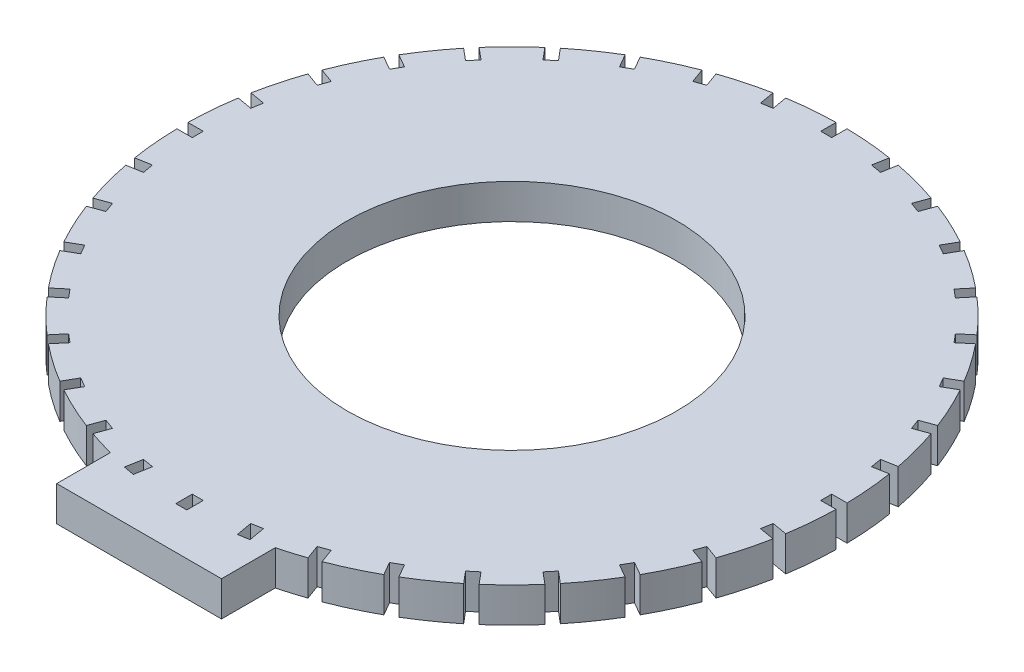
SolidWorks part; units mm, degrees
ref_plane "Front Plane" through (0, 0, 0) normal (0, 0, 1) x (1, 0, 0)
ref_plane "Top Plane" through (0, 0, 0) normal (0, 1, 0) x (1, 0, 0)
ref_plane "Right Plane" through (0, 0, 0) normal (1, 0, 0) x (0, 0, -1)
sketch "Sketch1" plane through (0, 0, 0) normal (0, 1, 0) x (1, 0, 0)
  line L0 (-7.5, -33.94) -> (-7.5, -29.0474)
  line L1 (7.5, -33.94) -> (7.5, -29.0474)
  line L2 (-7.5, -33.94) -> (7.5, -33.94)
  line L3 (0, -33.94) -> (0, -30) construction
  circle A0 centre (0, 0) radius 15
  circle A1 centre (0, 0) radius 30
  dimension "D3" = 15
  dimension "D2" = 15
  dimension "D4" = 33.94
  dimension "D1" = 15
extrude "Boss-Extrude1" add sketch "Sketch1" along normal blind 3.175 contours A1 A0 | L2 L3 A1 L0 | L3 L2 L1 A1
sketch "Sketch2" plane through (0, 3.175, 0) normal (0, 1, 0) x (1, 0, 0)
  line L0 (4.474, 28.2523) -> (4.7345, 29.7295)
  line L1 (-0.5, 28.6) -> (0.5, 28.6)
  line L2 (-0.5, 28.6) -> (-0.5, 30.1)
  line L3 (-0.5, 30.1) -> (0.5, 30.1)
  line L4 (0.5, 28.6) -> (0.5, 30.1)
  line L5 (-0.5, 28.6) -> (0.5, 30.1) construction
  line L6 (-0.5, 30.1) -> (0.5, 28.6) construction
  line L7 (4.474, 28.2523) -> (5.4588, 28.0787)
  line L8 (5.4588, 28.0787) -> (5.7193, 29.5559)
  line L9 (4.7345, 29.7295) -> (5.7193, 29.5559)
  line L10 (4.474, 28.2523) -> (5.7193, 29.5559) construction
  line L11 (4.7345, 29.7295) -> (5.4588, 28.0787) construction
  line L12 (9.3121, 27.0462) -> (9.8251, 28.4557)
  line L13 (9.3121, 27.0462) -> (10.2518, 26.7042)
  line L14 (10.2518, 26.7042) -> (10.7648, 28.1137)
  line L15 (9.8251, 28.4557) -> (10.7648, 28.1137)
  line L16 (9.3121, 27.0462) -> (10.7648, 28.1137) construction
  line L17 (9.8251, 28.4557) -> (10.2518, 26.7042) construction
  line L18 (13.8672, 25.0183) -> (14.6172, 26.3173)
  line L19 (13.8672, 25.0183) -> (14.7333, 24.5183)
  line L20 (14.7333, 24.5183) -> (15.4833, 25.8173)
  line L21 (14.6172, 26.3173) -> (15.4833, 25.8173)
  line L22 (13.8672, 25.0183) -> (15.4833, 25.8173) construction
  line L23 (14.6172, 26.3173) -> (14.7333, 24.5183) construction
  line L24 (18.001, 22.2302) -> (18.9652, 23.3792)
  line L25 (18.001, 22.2302) -> (18.7671, 21.5874)
  line L26 (18.7671, 21.5874) -> (19.7312, 22.7364)
  line L27 (18.9652, 23.3792) -> (19.7312, 22.7364)
  line L28 (18.001, 22.2302) -> (19.7312, 22.7364) construction
  line L29 (18.9652, 23.3792) -> (18.7671, 21.5874) construction
  line L30 (21.5878, 18.7666) -> (22.7369, 19.7308)
  line L31 (21.5878, 18.7666) -> (22.2306, 18.0005)
  line L32 (22.2306, 18.0005) -> (23.3797, 18.9647)
  line L33 (22.7369, 19.7308) -> (23.3797, 18.9647)
  line L34 (21.5878, 18.7666) -> (23.3797, 18.9647) construction
  line L35 (22.7369, 19.7308) -> (22.2306, 18.0005) construction
  line L36 (24.5187, 14.7328) -> (25.8178, 15.4828)
  line L37 (24.5187, 14.7328) -> (25.0187, 13.8667)
  line L38 (25.0187, 13.8667) -> (26.3178, 14.6167)
  line L39 (25.8178, 15.4828) -> (26.3178, 14.6167)
  line L40 (24.5187, 14.7328) -> (26.3178, 14.6167) construction
  line L41 (25.8178, 15.4828) -> (25.0187, 13.8667) construction
  line L42 (26.7046, 10.2513) -> (28.1142, 10.7643)
  line L43 (26.7046, 10.2513) -> (27.0467, 9.3116)
  line L44 (27.0467, 9.3116) -> (28.4562, 9.8246)
  line L45 (28.1142, 10.7643) -> (28.4562, 9.8246)
  line L46 (26.7046, 10.2513) -> (28.4562, 9.8246) construction
  line L47 (28.1142, 10.7643) -> (27.0467, 9.3116) construction
  line L48 (28.0791, 5.4583) -> (29.5564, 5.7188)
  line L49 (28.0791, 5.4583) -> (28.2528, 4.4735)
  line L50 (28.2528, 4.4735) -> (29.73, 4.734)
  line L51 (29.5564, 5.7188) -> (29.73, 4.734)
  line L52 (28.0791, 5.4583) -> (29.73, 4.734) construction
  line L53 (29.5564, 5.7188) -> (28.2528, 4.4735) construction
  line L54 (28.6005, 0.4995) -> (30.1005, 0.4995)
  line L55 (28.6005, 0.4995) -> (28.6005, -0.5005)
  line L56 (28.6005, -0.5005) -> (30.1005, -0.5005)
  line L57 (30.1005, 0.4995) -> (30.1005, -0.5005)
  line L58 (28.6005, 0.4995) -> (30.1005, -0.5005) construction
  line L59 (30.1005, 0.4995) -> (28.6005, -0.5005) construction
  line L60 (28.2528, -4.4745) -> (29.73, -4.735)
  line L61 (28.2528, -4.4745) -> (28.0791, -5.4593)
  line L62 (28.0791, -5.4593) -> (29.5564, -5.7198)
  line L63 (29.73, -4.735) -> (29.5564, -5.7198)
  line L64 (28.2528, -4.4745) -> (29.5564, -5.7198) construction
  line L65 (29.73, -4.735) -> (28.0791, -5.4593) construction
  line L66 (27.0467, -9.3126) -> (28.4562, -9.8256)
  line L67 (27.0467, -9.3126) -> (26.7046, -10.2523)
  line L68 (26.7046, -10.2523) -> (28.1142, -10.7653)
  line L69 (28.4562, -9.8256) -> (28.1142, -10.7653)
  line L70 (27.0467, -9.3126) -> (28.1142, -10.7653) construction
  line L71 (28.4562, -9.8256) -> (26.7046, -10.2523) construction
  line L72 (25.0187, -13.8677) -> (26.3178, -14.6177)
  line L73 (25.0187, -13.8677) -> (24.5187, -14.7337)
  line L74 (24.5187, -14.7337) -> (25.8178, -15.4837)
  line L75 (26.3178, -14.6177) -> (25.8178, -15.4837)
  line L76 (25.0187, -13.8677) -> (25.8178, -15.4837) construction
  line L77 (26.3178, -14.6177) -> (24.5187, -14.7337) construction
  line L78 (22.2306, -18.0015) -> (23.3797, -18.9657)
  line L79 (22.2306, -18.0015) -> (21.5878, -18.7675)
  line L80 (21.5878, -18.7675) -> (22.7369, -19.7317)
  line L81 (23.3797, -18.9657) -> (22.7369, -19.7317)
  line L82 (22.2306, -18.0015) -> (22.7369, -19.7317) construction
  line L83 (23.3797, -18.9657) -> (21.5878, -18.7675) construction
  line L84 (18.7671, -21.5883) -> (19.7312, -22.7374)
  line L85 (18.7671, -21.5883) -> (18.001, -22.2311)
  line L86 (18.001, -22.2311) -> (18.9652, -23.3802)
  line L87 (19.7312, -22.7374) -> (18.9652, -23.3802)
  line L88 (18.7671, -21.5883) -> (18.9652, -23.3802) construction
  line L89 (19.7312, -22.7374) -> (18.001, -22.2311) construction
  line L90 (14.7333, -24.5192) -> (15.4833, -25.8183)
  line L91 (14.7333, -24.5192) -> (13.8672, -25.0192)
  line L92 (13.8672, -25.0192) -> (14.6172, -26.3183)
  line L93 (15.4833, -25.8183) -> (14.6172, -26.3183)
  line L94 (14.7333, -24.5192) -> (14.6172, -26.3183) construction
  line L95 (15.4833, -25.8183) -> (13.8672, -25.0192) construction
  line L96 (10.2518, -26.7051) -> (10.7648, -28.1147)
  line L97 (10.2518, -26.7051) -> (9.3121, -27.0471)
  line L98 (9.3121, -27.0471) -> (9.8251, -28.4567)
  line L99 (10.7648, -28.1147) -> (9.8251, -28.4567)
  line L100 (10.2518, -26.7051) -> (9.8251, -28.4567) construction
  line L101 (10.7648, -28.1147) -> (9.3121, -27.0471) construction
  line L102 (5.4588, -28.0796) -> (5.7193, -29.5568)
  line L103 (5.4588, -28.0796) -> (4.474, -28.2533)
  line L104 (4.474, -28.2533) -> (4.7345, -29.7305)
  line L105 (5.7193, -29.5568) -> (4.7345, -29.7305)
  line L106 (5.4588, -28.0796) -> (4.7345, -29.7305) construction
  line L107 (5.7193, -29.5568) -> (4.474, -28.2533) construction
  line L108 (0.5, -28.601) -> (0.5, -30.101)
  line L109 (0.5, -28.601) -> (-0.5, -28.601)
  line L110 (-0.5, -28.601) -> (-0.5, -30.101)
  line L111 (0.5, -30.101) -> (-0.5, -30.101)
  line L112 (0.5, -28.601) -> (-0.5, -30.101) construction
  line L113 (0.5, -30.101) -> (-0.5, -28.601) construction
  line L114 (-4.474, -28.2533) -> (-4.7345, -29.7305)
  line L115 (-4.474, -28.2533) -> (-5.4588, -28.0796)
  line L116 (-5.4588, -28.0796) -> (-5.7193, -29.5568)
  line L117 (-4.7345, -29.7305) -> (-5.7193, -29.5568)
  line L118 (-4.474, -28.2533) -> (-5.7193, -29.5568) construction
  line L119 (-4.7345, -29.7305) -> (-5.4588, -28.0796) construction
  line L120 (-9.3121, -27.0471) -> (-9.8251, -28.4567)
  line L121 (-9.3121, -27.0471) -> (-10.2518, -26.7051)
  line L122 (-10.2518, -26.7051) -> (-10.7648, -28.1147)
  line L123 (-9.8251, -28.4567) -> (-10.7648, -28.1147)
  line L124 (-9.3121, -27.0471) -> (-10.7648, -28.1147) construction
  line L125 (-9.8251, -28.4567) -> (-10.2518, -26.7051) construction
  line L126 (-13.8672, -25.0192) -> (-14.6172, -26.3183)
  line L127 (-13.8672, -25.0192) -> (-14.7333, -24.5192)
  line L128 (-14.7333, -24.5192) -> (-15.4833, -25.8183)
  line L129 (-14.6172, -26.3183) -> (-15.4833, -25.8183)
  line L130 (-13.8672, -25.0192) -> (-15.4833, -25.8183) construction
  line L131 (-14.6172, -26.3183) -> (-14.7333, -24.5192) construction
  line L132 (-18.001, -22.2311) -> (-18.9652, -23.3802)
  line L133 (-18.001, -22.2311) -> (-18.7671, -21.5883)
  line L134 (-18.7671, -21.5883) -> (-19.7312, -22.7374)
  line L135 (-18.9652, -23.3802) -> (-19.7312, -22.7374)
  line L136 (-18.001, -22.2311) -> (-19.7312, -22.7374) construction
  line L137 (-18.9652, -23.3802) -> (-18.7671, -21.5883) construction
  line L138 (-21.5878, -18.7675) -> (-22.7369, -19.7317)
  line L139 (-21.5878, -18.7675) -> (-22.2306, -18.0015)
  line L140 (-22.2306, -18.0015) -> (-23.3797, -18.9657)
  line L141 (-22.7369, -19.7317) -> (-23.3797, -18.9657)
  line L142 (-21.5878, -18.7675) -> (-23.3797, -18.9657) construction
  line L143 (-22.7369, -19.7317) -> (-22.2306, -18.0015) construction
  line L144 (-24.5187, -14.7337) -> (-25.8178, -15.4837)
  line L145 (-24.5187, -14.7337) -> (-25.0187, -13.8677)
  line L146 (-25.0187, -13.8677) -> (-26.3178, -14.6177)
  line L147 (-25.8178, -15.4837) -> (-26.3178, -14.6177)
  line L148 (-24.5187, -14.7337) -> (-26.3178, -14.6177) construction
  line L149 (-25.8178, -15.4837) -> (-25.0187, -13.8677) construction
  line L150 (-26.7046, -10.2523) -> (-28.1142, -10.7653)
  line L151 (-26.7046, -10.2523) -> (-27.0467, -9.3126)
  line L152 (-27.0467, -9.3126) -> (-28.4562, -9.8256)
  line L153 (-28.1142, -10.7653) -> (-28.4562, -9.8256)
  line L154 (-26.7046, -10.2523) -> (-28.4562, -9.8256) construction
  line L155 (-28.1142, -10.7653) -> (-27.0467, -9.3126) construction
  line L156 (-28.0791, -5.4593) -> (-29.5564, -5.7198)
  line L157 (-28.0791, -5.4593) -> (-28.2528, -4.4745)
  line L158 (-28.2528, -4.4745) -> (-29.73, -4.735)
  line L159 (-29.5564, -5.7198) -> (-29.73, -4.735)
  line L160 (-28.0791, -5.4593) -> (-29.73, -4.735) construction
  line L161 (-29.5564, -5.7198) -> (-28.2528, -4.4745) construction
  line L162 (-28.6005, -0.5005) -> (-30.1005, -0.5005)
  line L163 (-28.6005, -0.5005) -> (-28.6005, 0.4995)
  line L164 (-28.6005, 0.4995) -> (-30.1005, 0.4995)
  line L165 (-30.1005, -0.5005) -> (-30.1005, 0.4995)
  line L166 (-28.6005, -0.5005) -> (-30.1005, 0.4995) construction
  line L167 (-30.1005, -0.5005) -> (-28.6005, 0.4995) construction
  line L168 (-28.2528, 4.4735) -> (-29.73, 4.734)
  line L169 (-28.2528, 4.4735) -> (-28.0791, 5.4583)
  line L170 (-28.0791, 5.4583) -> (-29.5564, 5.7188)
  line L171 (-29.73, 4.734) -> (-29.5564, 5.7188)
  line L172 (-28.2528, 4.4735) -> (-29.5564, 5.7188) construction
  line L173 (-29.73, 4.734) -> (-28.0791, 5.4583) construction
  line L174 (-27.0467, 9.3116) -> (-28.4562, 9.8246)
  line L175 (-27.0467, 9.3116) -> (-26.7046, 10.2513)
  line L176 (-26.7046, 10.2513) -> (-28.1142, 10.7643)
  line L177 (-28.4562, 9.8246) -> (-28.1142, 10.7643)
  line L178 (-27.0467, 9.3116) -> (-28.1142, 10.7643) construction
  line L179 (-28.4562, 9.8246) -> (-26.7046, 10.2513) construction
  line L180 (-25.0187, 13.8667) -> (-26.3178, 14.6167)
  line L181 (-25.0187, 13.8667) -> (-24.5187, 14.7328)
  line L182 (-24.5187, 14.7328) -> (-25.8178, 15.4828)
  line L183 (-26.3178, 14.6167) -> (-25.8178, 15.4828)
  line L184 (-25.0187, 13.8667) -> (-25.8178, 15.4828) construction
  line L185 (-26.3178, 14.6167) -> (-24.5187, 14.7328) construction
  line L186 (-22.2306, 18.0005) -> (-23.3797, 18.9647)
  line L187 (-22.2306, 18.0005) -> (-21.5878, 18.7666)
  line L188 (-21.5878, 18.7666) -> (-22.7369, 19.7308)
  line L189 (-23.3797, 18.9647) -> (-22.7369, 19.7308)
  line L190 (-22.2306, 18.0005) -> (-22.7369, 19.7308) construction
  line L191 (-23.3797, 18.9647) -> (-21.5878, 18.7666) construction
  line L192 (-18.7671, 21.5874) -> (-19.7312, 22.7364)
  line L193 (-18.7671, 21.5874) -> (-18.001, 22.2302)
  line L194 (-18.001, 22.2302) -> (-18.9652, 23.3792)
  line L195 (-19.7312, 22.7364) -> (-18.9652, 23.3792)
  line L196 (-18.7671, 21.5874) -> (-18.9652, 23.3792) construction
  line L197 (-19.7312, 22.7364) -> (-18.001, 22.2302) construction
  line L198 (-14.7333, 24.5183) -> (-15.4833, 25.8173)
  line L199 (-14.7333, 24.5183) -> (-13.8672, 25.0183)
  line L200 (-13.8672, 25.0183) -> (-14.6172, 26.3173)
  line L201 (-15.4833, 25.8173) -> (-14.6172, 26.3173)
  line L202 (-14.7333, 24.5183) -> (-14.6172, 26.3173) construction
  line L203 (-15.4833, 25.8173) -> (-13.8672, 25.0183) construction
  line L204 (-10.2518, 26.7042) -> (-10.7648, 28.1137)
  line L205 (-10.2518, 26.7042) -> (-9.3121, 27.0462)
  line L206 (-9.3121, 27.0462) -> (-9.8251, 28.4557)
  line L207 (-10.7648, 28.1137) -> (-9.8251, 28.4557)
  line L208 (-10.2518, 26.7042) -> (-9.8251, 28.4557) construction
  line L209 (-10.7648, 28.1137) -> (-9.3121, 27.0462) construction
  line L210 (-5.4588, 28.0787) -> (-5.7193, 29.5559)
  line L211 (-5.4588, 28.0787) -> (-4.474, 28.2523)
  line L212 (-4.474, 28.2523) -> (-4.7345, 29.7295)
  line L213 (-5.7193, 29.5559) -> (-4.7345, 29.7295)
  line L214 (-5.4588, 28.0787) -> (-4.7345, 29.7295) construction
  line L215 (-5.7193, 29.5559) -> (-4.474, 28.2523) construction
  line L216 (0, 30.1) -> (0, 28.6) construction
  line L217 (-0.5, 30) -> (0.5, 30) construction
  arc A2 (7.5, -29.0474) -> (-7.5, -29.0474) centre (0, 0) ccw construction
  point P4 (0, 29.35)
  point P14 (5.0967, 28.9041)
  point P19 (10.0385, 27.5799)
  point P24 (14.6752, 25.4178)
  point P29 (18.8661, 22.4833)
  point P34 (22.4838, 18.8656)
  point P39 (25.4183, 14.6748)
  point P44 (27.5804, 10.038)
  point P49 (28.9046, 5.0962)
  point P54 (29.3505, -0.0005)
  point P59 (28.9046, -5.0971)
  point P64 (27.5804, -10.0389)
  point P69 (25.4183, -14.6757)
  point P74 (22.4838, -18.8666)
  point P79 (18.8661, -22.4842)
  point P84 (14.6752, -25.4187)
  point P89 (10.0385, -27.5809)
  point P94 (5.0967, -28.9051)
  point P99 (0, -29.351)
  point P104 (-5.0967, -28.9051)
  point P109 (-10.0385, -27.5809)
  point P114 (-14.6752, -25.4187)
  point P119 (-18.8661, -22.4842)
  point P124 (-22.4838, -18.8666)
  point P129 (-25.4183, -14.6757)
  point P134 (-27.5804, -10.0389)
  point P139 (-28.9046, -5.0971)
  point P144 (-29.3505, -0.0005)
  point P149 (-28.9046, 5.0962)
  point P154 (-27.5804, 10.038)
  point P159 (-25.4183, 14.6748)
  point P164 (-22.4838, 18.8656)
  point P169 (-18.8661, 22.4833)
  point P174 (-14.6752, 25.4178)
  point P179 (-10.0385, 27.5799)
  point P184 (-5.0967, 28.9041)
  point P185 (0, -0.0005)
  point P188 (0, 30)
  point P189 (0, 0)
  dimension "D1" = 1
  dimension "D2" = 1.5
  dimension "D4" = 0.1
  dimension "D3" = 36
extrude "Cut-Extrude1" cut sketch "Sketch2" against normal up to next (3.175 mm away)
